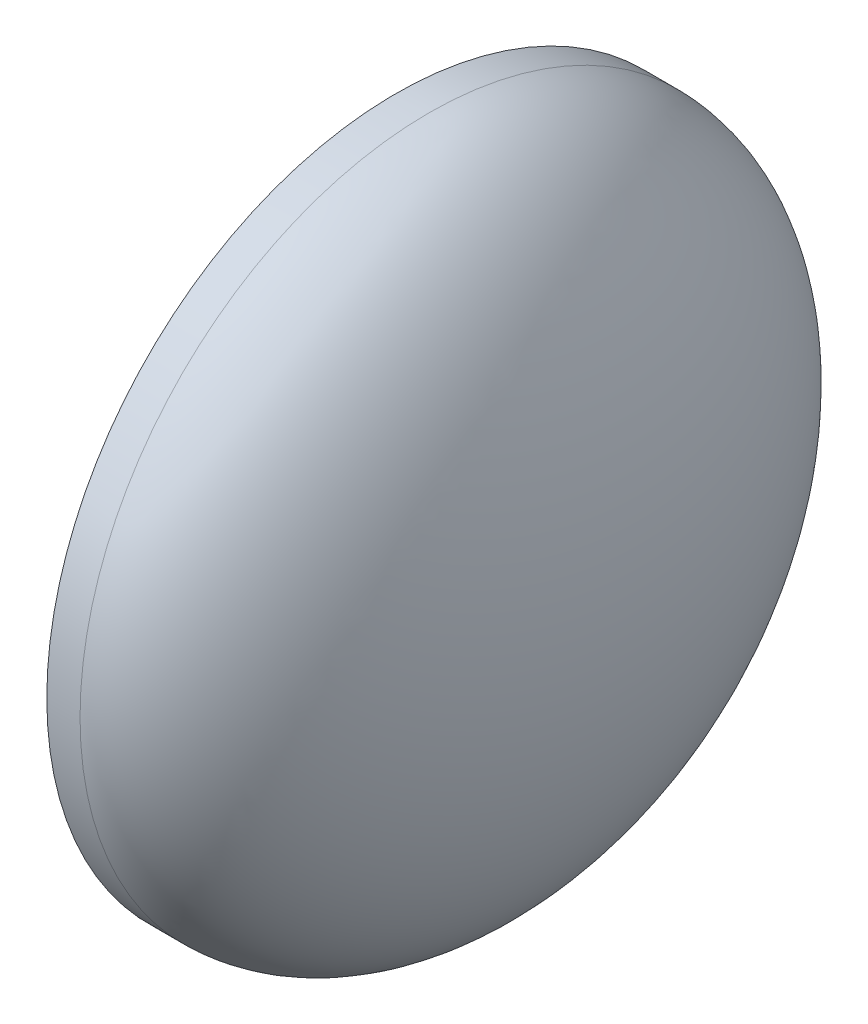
SolidWorks part; units mm, degrees
ref_plane "Front Plane" through (0, 0, 0) normal (0, 0, 1) x (1, 0, 0)
ref_plane "Top Plane" through (0, 0, 0) normal (0, 1, 0) x (1, 0, 0)
ref_plane "Right Plane" through (0, 0, 0) normal (1, 0, 0) x (0, 0, -1)
sketch "Sketch1" plane through (0, 0, 0) normal (0, 0, 1) x (1, 0, 0)
  line L0 (1828.8, 533.4) -> (1828.8, 520.7) construction
  line L1 (1879.6, 520.7) -> (1828.8, 520.7) construction
  line L2 (2139.95, 0) -> (2152.65, 0) construction
  line L3 (1879.6, 533.4) -> (1828.8, 533.4) construction
  line L4 (1828.8, 533.4) -> (1828.8, 520.7)
  line L5 (1879.6, 520.7) -> (1828.8, 520.7)
  line L6 (2139.95, 0) -> (2152.65, 0)
  line L7 (1879.6, 533.4) -> (1828.8, 533.4)
  line L8 (1828.8, 0) -> (2895.6, 0) construction
  line L9 (1828.8, 0) -> (2895.6, 0) construction
  ellipse E0 centre (1879.6, 0) end of major axis (1879.6, 533.4) minor radius 273.05 (2152.65, 0) -> (1879.6, 533.4) ccw construction
  ellipse E1 centre (1879.6, 0) end of major axis (1879.6, 533.4) minor radius 273.05 (2152.65, 0) -> (1879.6, 533.4) ccw
  spline S0 degree 3 poles (-9584.6616, -5434.4855) (1047.6611, -1569.3976) (1467.3419, 581.4322) (1908.0273, 517.9715) (1928.2977, 512.1077) (1952.4534, 500.3038) (1984.1361, 478.1847) (2022.0537, 438.6874) (2062.5345, 373.86) (2096.032, 294.1752) (2116.8678, 218.0502) (2128.7561, 153.1417) (2135.1935, 102.9448) (2138.4344, 60.2634) (2170.7393, -795.2431) (1174.2759, -1747.2738) (-962.2105, 12404.975) knots -6.701322 -6.701322 -6.701322 -6.701322 -1.521709 -1.472622 -1.374447 -1.276272 -1.178097 -0.981748 -0.785398 -0.589049 -0.392699 -0.294524 -0.19635 -0.098175 -0.049087 4.687017 4.687017 4.687017 4.687017 only from (1879.6, 520.7) to (2139.95, 0) construction
  spline S1 degree 3 poles (1879.6, 520.7) (1883.6662, 520.7) (1891.7836, 520.3106) (1908.0273, 517.9715) (1928.2977, 512.1077) (1952.4534, 500.3038) (1984.1361, 478.1847) (2022.0537, 438.6874) (2062.5345, 373.86) (2096.032, 294.1752) (2116.8678, 218.0502) (2128.7561, 153.1417) (2135.1935, 102.9448) (2138.4344, 60.2634) (2139.7333, 25.8654) (2139.95, 8.6185) (2139.95, 0) knots -1.570796 -1.570796 -1.570796 -1.570796 -1.521709 -1.472622 -1.374447 -1.276272 -1.178097 -0.981748 -0.785398 -0.589049 -0.392699 -0.294524 -0.19635 -0.098175 -0.049087 0 0 0 0
revolve "Revolve1" add sketch "Sketch1" angle 360 about L9
